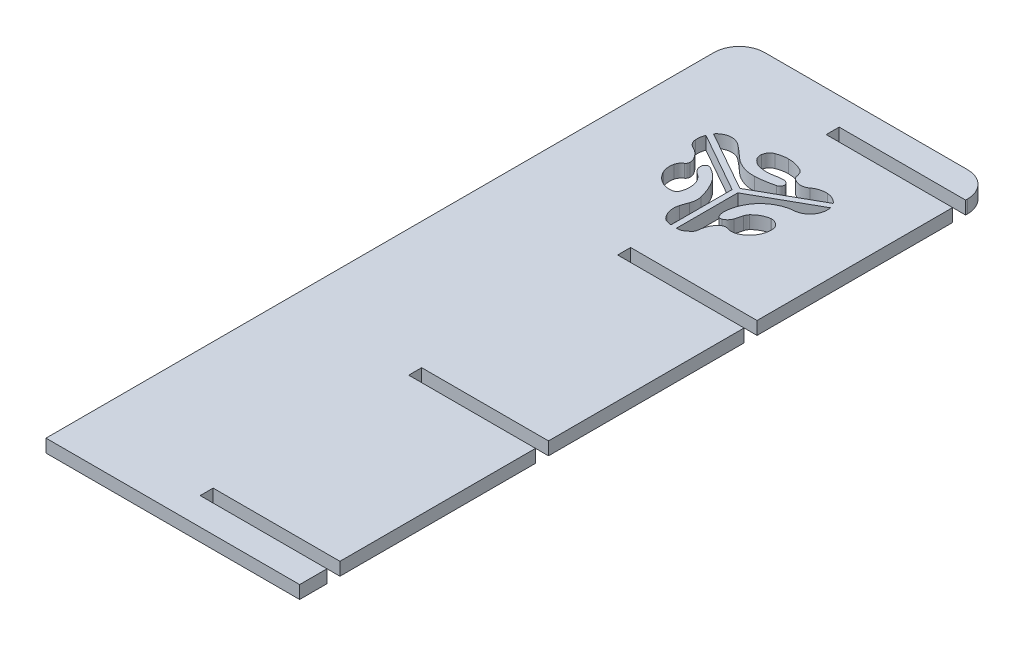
SolidWorks part; units mm, degrees
ref_plane "Alzado" through (0, 0, 0) normal (0, 0, 1) x (1, 0, 0)
ref_plane "Planta" through (0, 0, 0) normal (0, 1, 0) x (1, 0, 0)
ref_plane "Vista lateral" through (0, 0, 0) normal (1, 0, 0) x (0, 0, -1)
sketch "Croquis1" plane through (0, 0, 0) normal (0, 1, 0) x (1, 0, 0)
  line L0 (-56.986, -430.7706) -> (393.014, -430.7706)
  line L1 (393.014, 750.7294) -> (393.014, 754.2294)
  line L2 (348.014, 799.2294) -> (-11.986, 799.2294)
  line L3 (-56.986, 754.2294) -> (-56.986, -430.7706)
  line L4 (393.014, -430.7706) -> (393.014, -382.2706)
  line L6 (168.014, -382.2706) -> (168.014, -359.2706)
  line L8 (393.014, -359.2706) -> (393.014, -12.2706)
  line L10 (168.014, -12.2706) -> (168.014, 10.7294)
  line L12 (393.014, 10.7294) -> (393.014, 357.7294)
  line L14 (168.7164, 357.7294) -> (168.7164, 380.7294)
  line L16 (393.014, 380.7294) -> (393.014, 727.7294)
  line L18 (168.7164, 727.7294) -> (168.7164, 750.7294)
  line L20 (180.3665, 576.0904) -> (692.3665, 576.0904) construction
  line L24 (63.0518, 620.0231) -> (169.7572, 559.7808)
  line L25 (179.7572, 559.7778) -> (285.0627, 619.09)
  line L26 (169.7572, 559.7808) -> (169.7066, 451.3363)
  line L27 (67.615, 628.9035) -> (174.7598, 568.4401)
  line L28 (174.7598, 568.4401) -> (280.7472, 628.1623)
  line L29 (179.7572, 559.7778) -> (179.7537, 450.9564)
  line L35 (393.014, 727.7294) -> (168.7164, 727.7294)
  line L36 (168.7164, 750.7294) -> (393.014, 750.7294)
  line L37 (168.7164, 380.7294) -> (393.014, 380.7294)
  line L38 (393.014, 357.7294) -> (168.7164, 357.7294)
  line L39 (168.014, 10.7294) -> (393.014, 10.7294)
  line L40 (393.014, -12.2706) -> (168.014, -12.2706)
  line L41 (168.014, -359.2706) -> (393.014, -359.2706)
  line L42 (393.014, -382.2706) -> (168.014, -382.2706)
  arc A0 (393.014, 754.2294) -> (348.014, 799.2294) centre (348.014, 754.2294) ccw
  arc A1 (-11.986, 799.2294) -> (-56.986, 754.2294) centre (-11.986, 754.2294) ccw
  arc A2 (285.0627, 619.09) -> (254.2099, 582.0711) centre (254.63, 613.0873) cw
  arc A3 (254.2099, 582.0711) -> (196.6524, 520.9969) centre (263.5383, 515.6211) ccw
  arc A4 (196.6524, 520.9969) -> (198.5695, 508.483) centre (224.0692, 518.7933) ccw
  arc A5 (198.5695, 508.483) -> (206.1119, 505.2838) centre (203.9403, 510.6546) ccw
  arc A6 (206.1119, 505.2838) -> (216.3593, 516.179) centre (199.4133, 521.8508) ccw
  arc A7 (216.3593, 516.179) -> (220.1881, 529.7573) centre (77.3668, 562.7001) ccw
  arc A8 (220.1881, 529.7573) -> (223.8335, 536.5525) centre (234.4958, 526.4571) cw
  arc A9 (223.8335, 536.5525) -> (248.8916, 549.7201) centre (255.6544, 506.4235) cw
  arc A10 (248.8916, 549.7201) -> (249.255, 549.7483) centre (249.255, 547.3938) cw
  arc A11 (249.255, 549.7483) -> (265.6981, 539.5914) centre (249.255, 531.36) cw
  arc A12 (265.6981, 539.5914) -> (266.7202, 535.9516) centre (256.7649, 535.1194) cw
  arc A13 (266.7202, 535.9516) -> (241.4001, 496.0709) centre (227.78, 532.6964) cw
  arc A14 (241.4001, 496.0709) -> (225.7046, 495.9796) centre (233.4274, 517.5103) cw
  arc A15 (225.7046, 495.9796) -> (214.3723, 493.9371) centre (221.811, 485.1242) ccw
  arc A16 (214.3723, 493.9371) -> (204.6431, 480.0069) centre (235.6812, 468.6917) ccw
  arc A17 (204.6431, 480.0069) -> (201.6781, 466.3217) centre (253.0804, 462.3487) ccw
  arc A18 (201.6781, 466.3217) -> (199.4133, 461.0985) centre (192.9708, 466.9947) cw
  arc A19 (199.4133, 461.0985) -> (190.4599, 453.6924) centre (168.3819, 489.498) cw
  arc A20 (190.4599, 453.6924) -> (183.1279, 451.205) centre (181.3719, 468.431) cw
  arc A21 (183.1279, 451.205) -> (179.7537, 450.9564) centre (177.0041, 511.2805) cw
  arc A22 (161.5355, 452.9086) -> (154.2434, 457.5732) centre (165.1694, 466.6214) cw
  arc A23 (154.2434, 457.5732) -> (150.2447, 463.5204) centre (181.9631, 480.529) cw
  arc A24 (150.2447, 463.5204) -> (147.6649, 488.7376) centre (179.6053, 479.2646) cw
  arc A25 (147.6649, 488.7376) -> (152.0957, 501.391) centre (280.2177, 449.4248) cw
  arc A26 (152.0957, 501.391) -> (153.5461, 520.4934) centre (122.9569, 513.2097) ccw
  arc A27 (153.5461, 520.4934) -> (142.3683, 549.406) centre (41.6396, 493.8469) ccw
  arc A28 (142.3683, 549.406) -> (115.9662, 574.4007) centre (89.9811, 520.5107) ccw
  arc A29 (115.9662, 574.4007) -> (106.6932, 570.1674) centre (113.0882, 568.4321) ccw
  arc A30 (106.6932, 570.1674) -> (108.7579, 558.849) centre (119.5802, 566.6706) ccw
  arc A31 (108.7579, 558.849) -> (115.0007, 552.8963) centre (127.9286, 572.7043) ccw
  arc A32 (115.0007, 552.8963) -> (127.9286, 533.7802) centre (98.7261, 527.9606) cw
  arc A33 (127.9286, 533.7802) -> (126.6375, 512.521) centre (86.897, 525.6033) cw
  arc A34 (126.6375, 512.521) -> (118.1476, 505.0286) centre (115.9945, 516.0245) cw
  arc A35 (118.1476, 505.0286) -> (113.8764, 504.6302) centre (114.0341, 526.0371) cw
  arc A36 (113.8764, 504.6302) -> (87.6336, 516.9404) centre (114.1317, 539.3019) cw
  arc A37 (87.6336, 516.9404) -> (82.0336, 525.0305) centre (127.0758, 550.2253) cw
  arc A38 (82.0336, 525.0305) -> (81.4244, 526.2283) centre (96.8984, 533.3453) cw
  arc A39 (81.4244, 526.2283) -> (79.3302, 547.0044) centre (110.6437, 539.6672) cw
  arc A40 (79.3302, 547.0044) -> (86.897, 557.7279) centre (96.3707, 543.0115) cw
  arc A41 (86.897, 557.7279) -> (90.4684, 564.2744) centre (82.6828, 564.2744) ccw
  arc A42 (90.4684, 564.2744) -> (88.0095, 573.5249) centre (71.8385, 564.2744) ccw
  arc A43 (88.0095, 573.5249) -> (70.0301, 589.9941) centre (53.2779, 553.6569) ccw
  arc A44 (70.0301, 589.9941) -> (60.7787, 603.4558) centre (76.7175, 604.4997) cw
  arc A45 (60.7787, 603.4558) -> (63.0518, 620.0231) centre (102.4149, 606.1828) cw
  arc A46 (67.615, 628.9035) -> (105.6064, 633.9963) centre (89.1179, 612.7463) cw
  arc A47 (105.6064, 633.9963) -> (126.6375, 615.9245) centre (-64.5533, 414.699) cw
  arc A48 (126.6375, 615.9245) -> (169.5128, 600.0926) centre (166.4839, 657.8624) ccw
  arc A49 (169.5128, 600.0926) -> (203.2598, 605.3957) centre (160.8557, 765.2103) ccw
  arc A50 (203.2598, 605.3957) -> (209.4748, 613.4748) centre (201.1162, 613.4748) ccw
  arc A51 (209.4748, 613.4748) -> (207.7413, 617.5638) centre (203.7857, 613.4748) ccw
  arc A52 (207.7413, 617.5638) -> (199.4133, 620.5908) centre (200.19, 609.7579) ccw
  arc A53 (199.4133, 620.5908) -> (185.1905, 618.6018) centre (207.0419, 514.1924) ccw
  arc A54 (185.1905, 618.6018) -> (160.8557, 618.6018) centre (173.0231, 676.7398) cw
  arc A55 (160.8557, 618.6018) -> (145.6332, 627.67) centre (166.4408, 645.2884) cw
  arc A56 (145.6332, 627.67) -> (142.0487, 639.643) centre (157.5507, 637.7609) cw
  arc A57 (142.0487, 639.643) -> (152.4872, 653.0945) centre (158.5106, 637.6443) cw
  arc A58 (152.4872, 653.0945) -> (173.0231, 656.956) centre (173.0231, 600.4191) cw
  arc A59 (173.0231, 656.956) -> (199.4133, 650.1991) centre (173.0231, 602.0416) cw
  arc A60 (199.4133, 650.1991) -> (204.6431, 644.2664) centre (193.825, 640.0015) cw
  arc A61 (204.6431, 644.2664) -> (206.5893, 637.6443) centre (168.7974, 630.1347) cw
  arc A62 (206.5893, 637.6443) -> (209.4748, 632.5242) centre (215.8343, 639.4814) ccw
  arc A63 (209.4748, 632.5242) -> (236.1576, 631.164) centre (223.641, 648.0219) ccw
  arc A64 (236.1576, 631.164) -> (259.9823, 638.4193) centre (258.2262, 601.4412) cw
  arc A65 (259.9823, 638.4193) -> (280.7472, 628.1623) centre (258.6085, 609.4906) cw
  arc A66 (169.7066, 451.3363) -> (161.5355, 452.9086) centre (177.0041, 511.2805) cw
  point P22 (393.014, 799.2294)
  dimension "D15" = 45
  dimension "D1" = 450
extrude "Saliente-Extruir1" add sketch "Croquis1" along normal blind 23
